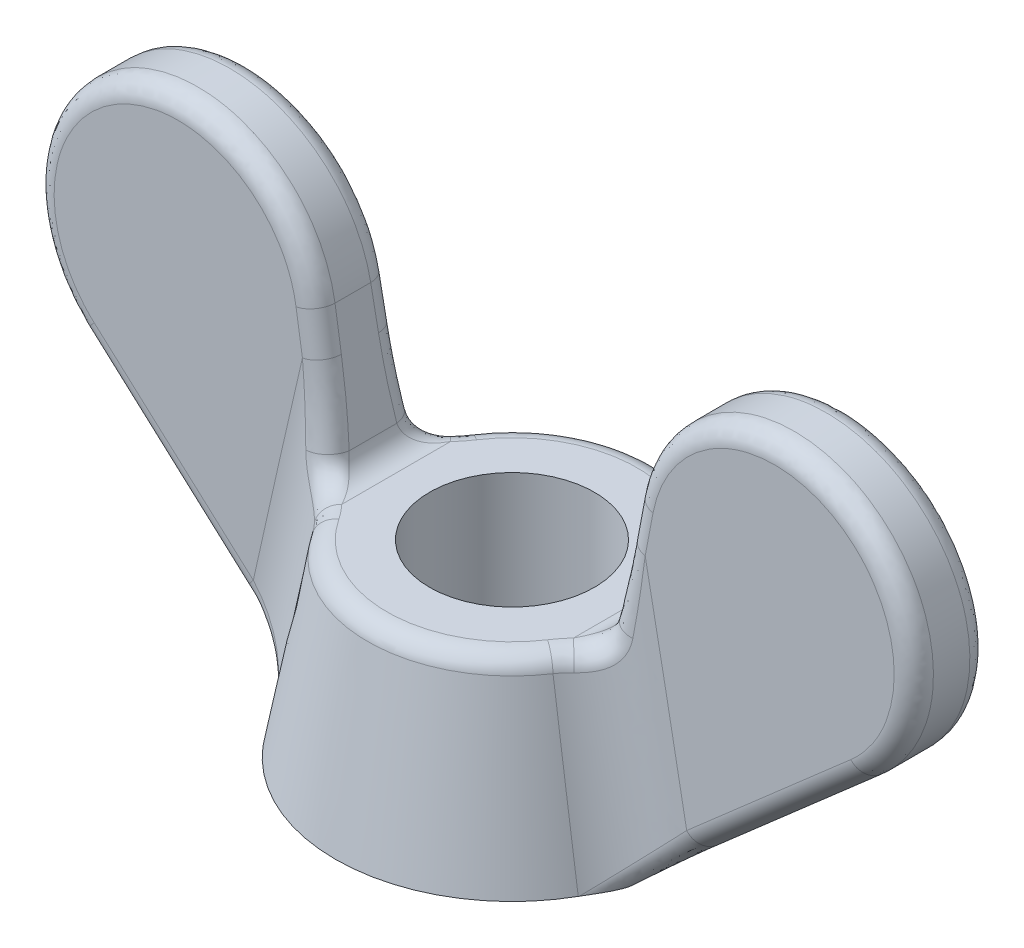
SolidWorks part; units mm, degrees
ref_plane "Front Plane" through (0, 0, 0) normal (0, 0, 1) x (1, 0, 0)
ref_plane "Top Plane" through (0, 0, 0) normal (0, 1, 0) x (1, 0, 0)
ref_plane "Right Plane" through (0, 0, 0) normal (1, 0, 0) x (0, 0, -1)
sketch "BaseNutSke" plane through (0, 0, 0) normal (0, 0, 1) x (1, 0, 0)
  line L0 (0, 0) -> (-22.5, 0)
  line L1 (-22.5, 0) -> (-18, 24)
  line L2 (-18, 24) -> (0, 24)
  line L3 (0, 24) -> (0, 0)
  line L4 (0, -38.5148) -> (0, 38.5148) construction
  dimension "Top_Width" = 36
  dimension "Bottom_Width" = 45
  dimension "Nut_Height" = 24
revolve "BaseNut" add sketch "BaseNutSke" angle 360 about L4
sketch "BaseWingSke" plane through (0, 0, 0) normal (1, 0, 0) x (0, 0, -1)
  line L0 (0, 0) -> (0, 62.8635) construction
  line L1 (-4.5, 56) -> (-5.5, 0)
  line L2 (-4.5, 56) -> (4.5, 56)
  line L3 (4.5, 56) -> (5.5, 0)
  line L4 (5.5, 0) -> (-5.5, 0)
  point P8 (0, 56)
  dimension "TopWing_Width" = 9
  dimension "BottomWing_Width" = 11
  dimension "Height" = 56
extrude "BaseWing" add sketch "BaseWingSke" along normal mid plane 112
sketch "CutWingSke" plane through (0, 0, 0) normal (0, 0, 1) x (1, 0, 0)
  line L0 (0, 0) -> (0, 84.5075) construction
  line L1 (-21.8174, 0) -> (-49.8318, 24.435)
  line L2 (-17.2708, 24) -> (-20.2704, 41.1085)
  line L3 (56, 56) -> (-56, 56) construction
  line L4 (-56, 56) -> (-56, 0) construction
  line L5 (-17.2708, 24) -> (17.2708, 24)
  line L6 (-21.8174, 0) -> (21.8174, 0)
  line L7 (21.8174, 0) -> (49.8318, 24.435)
  line L8 (17.2708, 24) -> (20.2704, 41.1085)
  line L9 (-21.8174, 0) -> (-56, 0) construction
  line L10 (-66, 66) -> (66, 66)
  line L11 (-66, 66) -> (-66, -10)
  line L12 (-66, -10) -> (66, -10)
  line L13 (66, 66) -> (66, -10)
  line L14 (56, 56) -> (56, 0) construction
  arc A0 (-20.2704, 41.1085) -> (-49.8318, 24.435) centre (-38, 38) ccw
  arc A1 (20.2704, 41.1085) -> (49.8318, 24.435) centre (38, 38) cw
  dimension "Radius1" = 18
  dimension "D1" = 10
  dimension "D2" = 10
  dimension "D3" = 10
  dimension "D4" = 10
extrude "CutWing" cut sketch "CutWingSke" against normal mid plane 112
sketch "HoleSke" plane through (0, 24, 0) normal (0, 1, 0) x (1, 0, 0)
  circle A0 centre (0, 0) radius 10.5
  dimension "Tap_drill" = 21
extrude "TappedHole" cut sketch "HoleSke" against normal through all
chamfer "Chamfer1" distance 1.4 angle 60 1 edges at (0, 0, 10.5)
sketch "ThdSchSke" plane through (0, 0, 0) normal (0, 0, 1) x (1, 0, 0)
  line L0 (10.5, 1.4) -> (8.7679, 1.4)
  line L1 (8.7679, 1.4) -> (8.7679, 3.1321)
  line L2 (8.7679, 3.1321) -> (10.5, 3.1321)
  line L3 (10.5, 3.1321) -> (12, 2.266)
  line L4 (12, 2.266) -> (10.5, 1.4)
  line L5 (0, -3.4614) -> (0, 8.4929) construction
  line L6 (-10.5, 1.4) -> (10.5, 1.4) construction
  dimension "D1" = 21
  dimension "ThreadN" = 24
revolve "ThreadSchematic" [suppressed] cut sketch "ThdSchSke" angle 360 about L5
pattern_linear "ThdSchPat" [suppressed]
fillet "Fillet1" radius 3 2 edges at (-17.2708, 24, 0) (17.2708, 24, 0)
fillet "Fillet2" radius 11 4 edges
fillet "Fillet3" radius 2.5 30 edges at (-24.7832, 2.5869, 6.1834) (24.0549, 1.9516, 6.5591) (39.0108, 14.9966, 5.2322) (47.1974, 53.4728, 4.5451) (17.0204, 25.0379, 7.5169) (0, 24, 18) (0, 24, -18) (-16.901, 24.9077, 7.6387) (24.7832, 2.5869, -6.1834) (39.0108, 14.9966, -5.2322) (47.1974, 53.4728, -4.5451) (16.901, 24.9077, -7.6387) (-17.0204, 25.0379, -7.5169) (-24.0549, 1.9516, -6.5591) (-39.0108, 14.9966, -5.2322) (-47.1974, 53.4728, 4.5451) (-39.0108, 14.9966, 5.2322) (-47.1974, 53.4728, -4.5451)
equation "\"D1@CutWing\" = \"Width@BaseWing\""
equation "\"D1@Chamfer1\" = \"Tap_drill@HoleSke\"/15"
equation "\"D1@ThdSchSke\" = \"Tap_drill@HoleSke\""
equation "\"ThreadN@ThdSchSke\" = \"Thread_major@ThreadCosmetic\""
equation "\"Num_threads@ThdSchPat\" = int( \"Nut_Height@BaseNutSke\"/\"Advance@ThdSchPat\" ) +1"
